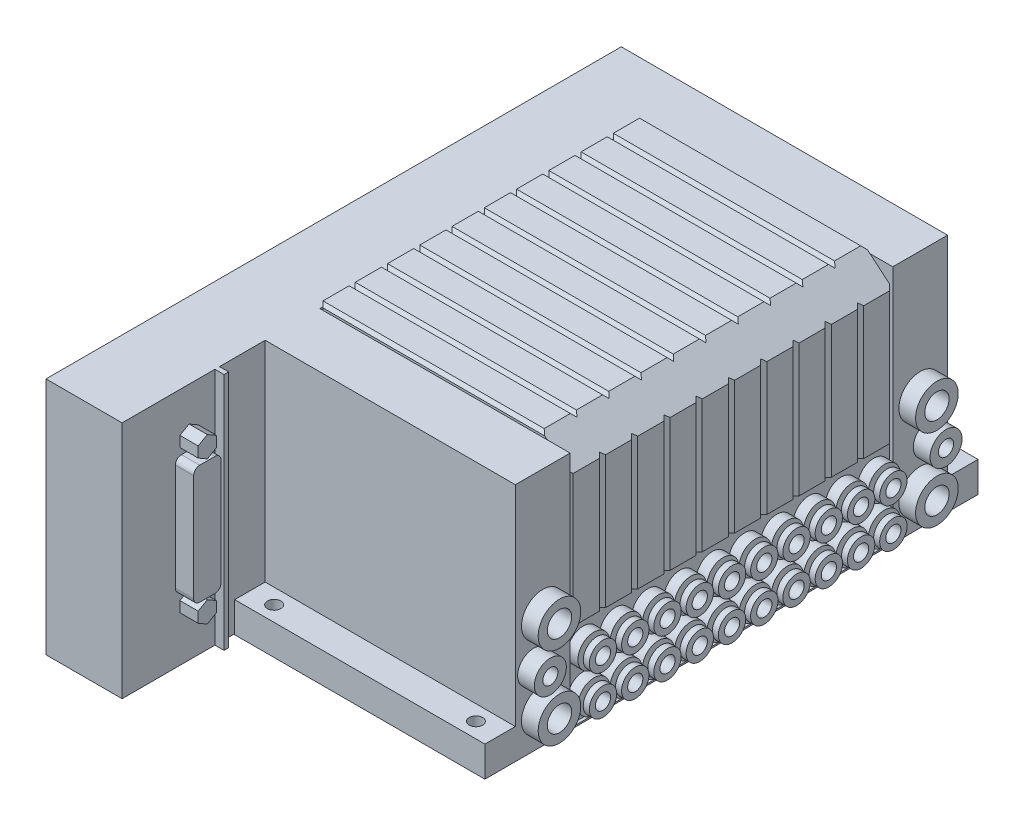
SolidWorks part; units mm, degrees
ref_plane "Längs" through (0, 0, 0) normal (0, 0, 1) x (1, 0, 0)
ref_plane "Oben" through (0, 0, 0) normal (0, 1, 0) x (1, 0, 0)
ref_plane "Quer" through (0, 0, 0) normal (1, 0, 0) x (0, 0, -1)
sketch "Skizze1" plane through (0, 0, 0) normal (0, 0, 1) x (1, 0, 0)
  line L0 (41.1, 40) -> (-41.1, -40) construction
  line L1 (-41.1, 40) -> (41.1, 40)
  line L2 (-41.1, 40) -> (-41.1, -40)
  line L3 (-41.1, -40) -> (41.1, -40)
  line L4 (41.1, 40) -> (41.1, -40)
  dimension "D1" = 82.2
  dimension "D2" = 80
extrude "Basis-Linear austragen" add sketch "Skizze1" along normal mid plane 10.6
sketch "Skizze2" plane through (41.1, 0, 0) normal (1, 0, 0) x (0, 0, -1)
  line L0 (5.3, -40) -> (5.3, 40) construction
  line L1 (-5.3, -40) -> (5.3, -40)
  line L2 (-5.3, -40) -> (-5.3, -11.5)
  line L3 (-5.3, -11.5) -> (5.3, -11.5)
  line L4 (5.3, -40) -> (5.3, -11.5)
  dimension "D1" = 28.5
extrude "Schnitt-Linear austragen1" cut sketch "Skizze2" against normal blind 1
sketch "Skizze3" plane through (0, 0, 0) normal (0, 0, 1) x (1, 0, 0)
  line L0 (26.5469, -19.3) -> (50.7651, -19.3) construction
  line L1 (43.6, -16.3) -> (44.6, -16.3)
  line L2 (40.1, -11.5) -> (40.1, -40) construction
  line L3 (44.6, -16.3) -> (44.6, -14.8)
  line L4 (44.6, -14.8) -> (46.6, -14.8)
  line L5 (46.6, -14.8) -> (46.6, -16.8)
  line L6 (46.6, -16.8) -> (40.1, -16.8)
  line L7 (40.1, -16.8) -> (40.1, -14.05)
  line L8 (-41.1, -40) -> (40.1, -40) construction
  line L10 (43.6, -16.3) -> (43.6, -14.05)
  line L11 (43.6, -14.05) -> (40.1, -14.05)
  line L12 (41.1, -11.5) -> (41.1, 40) construction
  dimension "D1" = 20.7
  dimension "D2" = 9
  dimension "D3" = 5
  dimension "D4" = 6
  dimension "D5" = 5.5
  dimension "D6" = 2
  dimension "D7" = 10.5
  dimension "D8" = 1
revolve "Aufsatz-Rotationskörper1" add sketch "Skizze3" angle 360 about L0
pattern_linear "Lineares Muster1" count 2 spacing 13
sketch "Skizze5" plane through (0, -11.5, 0) normal (0, -1, 0) x (1, 0, 0)
  line L0 (40.1, -5.3) -> (41.1, -4.3)
  line L4 (41.1, -5.3) -> (41.1, 5.3) construction
  line L5 (40.1, -5.3) -> (41.1, -5.3)
  line L6 (41.1, -4.3) -> (41.1, -5.3)
  dimension "D1" = 5.3
  dimension "D2" = 45
  dimension "D3" = 1
sketch "Skizze6" plane through (-41.1, 0, 0) normal (-1, 0, 0) x (0, 0, 1)
  line L0 (-5.3, 39) -> (-4.3, 40)
  line L3 (5.3, 40) -> (-5.3, 40) construction
  line L5 (-4.3, 40) -> (-5.3, 40)
  line L6 (-5.3, 39) -> (-5.3, 40)
  dimension "D1" = 5.3
  dimension "D2" = 1
  dimension "D3" = 45
extrude "Schnitt-Linear austragen9" cut sketch "Skizze6" against normal through all
sketch "Skizze7" plane through (0, -40, 0) normal (0, -1, 0) x (1, 0, 0)
  line L0 (-41.1, -4.3) -> (-40.1, -5.3)
  line L1 (-41.1, 5.3) -> (-41.1, -5.3) construction
  line L2 (-41.1, -4.3) -> (-41.1, -5.3)
  line L3 (-40.1, -5.3) -> (-41.1, -5.3)
  dimension "D1" = 5.3
  dimension "D2" = 45
  dimension "D3" = 1
extrude "Schnitt-Linear austragen11" cut sketch "Skizze7" against normal through all
extrude "Schnitt-Linear austragen8" cut sketch "Skizze5" against normal through all
mirror "Spiegeln1" about plane through (0, 0, 0) normal (0, 0, 1)
sketch "Skizze8" plane through (0, 0, 0) normal (0, 0, 1) x (1, 0, 0)
  line L0 (31.566, 40) -> (41.1, 32)
  line L3 (31.566, 40) -> (41.1, 40)
  line L4 (41.1, 32) -> (41.1, 40)
  line L5 (41.1, -11.5) -> (41.1, 40) construction
  dimension "D1" = 40
  dimension "D2" = 32
  dimension "D3" = 40
extrude "Schnitt-Linear austragen10" cut sketch "Skizze8" against normal mid plane 10.6
pattern_linear "Lineares Muster6" count 10 spacing 10.6
pattern_linear "Lineares Muster7" count 10 spacing 10.6
sketch "Skizze9" plane through (0, 0, 0) normal (1, 0, 0) x (0, 0, -1)
  line L0 (47.7, 55.0882) -> (47.7, -52.2534) construction
  line L2 (-5.3, 32.8391) -> (-5.3, -11.5) construction
  line L3 (-23.3, 38.3) -> (-23.3, -30.5)
  line L4 (-23.3, -30.5) -> (-33.3, -30.5)
  line L5 (-33.3, -30.5) -> (-33.3, -40.5)
  line L6 (-33.3, -40.5) -> (128.7, -40.5)
  line L7 (128.7, -40.5) -> (128.7, -30.5)
  line L8 (128.7, -30.5) -> (118.7, -30.5)
  line L9 (118.7, -30.5) -> (118.7, 38.3)
  line L10 (118.7, 38.3) -> (100.7, 38.3)
  line L11 (100.7, 38.3) -> (100.7, -40)
  line L12 (100.7, -40) -> (-5.3, -40)
  line L13 (-5.3, -40) -> (-5.3, 38.3)
  line L14 (-5.3, 38.3) -> (-23.3, 38.3)
  line L15 (-5.3, -40) -> (100.7, -40) construction
  line L16 (-5.3, -11.5) -> (-5.3, -40) construction
  dimension "D1" = 78.8
  dimension "D2" = 0.5
  dimension "D3" = 28
  dimension "D4" = 10
  dimension "D5" = 10
  dimension "3er-10er" = 53
extrude "Aufsatz-Linear austragen1" add sketch "Skizze9" along normal mid plane 82.2
hole_wizard "Ø 4.400000 Bohrung1" positions "Skizze11" profile "Skizze10" hole size "M4.4" standard "DIN"
sketch "Skizze11" plane through (0, -30.5, 0) normal (0, 1, 0) x (-1, 0, 0)
  line L0 (47.3303, -47.7) -> (-67.1929, -47.7) construction
  line L2 (-41.1, -128.7) -> (41.1, -128.7) construction
  line L3 (-41.1, 33.3) -> (41.1, 33.3) construction
  line L4 (0, 38.0034) -> (0, 16.4595) construction
  point P0 (-33.15, 28.3)
  point P1 (33.15, 28.3)
  point P2 (33.15, -123.7)
  point P3 (-33.15, -123.7)
  dimension "D1" = 5
  dimension "D2" = 66.3
sketch "Skizze10" plane through (33.15, -30.5, 28.3) normal (1, 0, 0) x (0, 0, 1)
  line L0 (0, 0) -> (0, 10)
  line L1 (0, 10) -> (2.2, 10)
  line L2 (2.2, 10) -> (2.2, 0)
  line L5 (2.2, 0) -> (0, 0)
  line L11 (0, -6.35) -> (0, 107.95) construction
  dimension "Bohrerdurchmesser" = 4.4
  dimension "Bohrungstiefe" = 10
sketch "Skizze13" plane through (0, 38.3, 0) normal (0, 1, 0) x (-1, 0, 0)
  line L0 (41.1, 38.3) -> (38.1, 38.3)
  line L1 (41.1, -118.7) -> (66.1, -118.7)
  line L2 (41.1, -118.7) -> (41.1, 38.3)
  line L3 (41.1, 70.3) -> (66.1, 70.3)
  line L4 (66.1, -118.7) -> (66.1, 70.3)
  line L5 (38.1, 38.3) -> (38.1, 39.8)
  line L6 (38.1, 39.8) -> (41.1, 39.8)
  line L7 (41.1, 39.8) -> (41.1, 70.3)
  line L9 (-41.1, 23.3) -> (41.1, 23.3) construction
  dimension "D1" = 25
  dimension "D2" = 3
  dimension "D3" = 15
  dimension "D4" = 1.5
  dimension "D5" = 47
extrude "Aufsatz-Linear austragen2" add sketch "Skizze13" against normal blind 78.5
sketch "Skizze14" plane through (-41.1, 0, 0) normal (1, 0, 0) x (0, 0, -1)
  line L0 (-48.3, 41.5333) -> (-48.3, -48.8758) construction
  line L1 (-50.8, 19.5) -> (-45.8, 19.5)
  line L2 (-52.8, 17.5) -> (-52.8, -17.5)
  line L3 (-50.8, -19.5) -> (-45.8, -19.5)
  line L4 (-43.8, 17.5) -> (-43.8, -17.5)
  line L5 (-75.3792, 0) -> (-45.8252, 0) construction
  line L6 (-23.3, 38.3) -> (-23.3, -30.5) construction
  line L8 (-45.3, 21.7679) -> (-45.3, 25.2321)
  line L9 (-45.3, 25.2321) -> (-48.3, 26.9641)
  line L10 (-48.3, 26.9641) -> (-51.3, 25.2321)
  line L11 (-51.3, 25.2321) -> (-51.3, 21.7679)
  line L12 (-51.3, 21.7679) -> (-48.3, 20.0359)
  line L13 (-48.3, 20.0359) -> (-45.3, 21.7679)
  line L14 (-48.3, -26.9641) -> (-45.3, -25.2321)
  line L15 (-45.3, -25.2321) -> (-45.3, -21.7679)
  line L16 (-45.3, -21.7679) -> (-48.3, -20.0359)
  line L17 (-48.3, -20.0359) -> (-51.3, -21.7679)
  line L18 (-51.3, -21.7679) -> (-51.3, -25.2321)
  line L19 (-51.3, -25.2321) -> (-48.3, -26.9641)
  arc A0 (-50.8, 19.5) -> (-52.8, 17.5) centre (-50.8, 17.5) ccw
  arc A1 (-45.8, 19.5) -> (-43.8, 17.5) centre (-45.8, 17.5) cw
  arc A2 (-45.8, -19.5) -> (-43.8, -17.5) centre (-45.8, -17.5) ccw
  arc A3 (-52.8, -17.5) -> (-50.8, -19.5) centre (-50.8, -17.5) ccw
  circle A4 centre (-48.3, 23.5) radius 3 construction
  circle A5 centre (-48.3, -23.5) radius 3 construction
  dimension "D4" = 2
  dimension "D1" = 25
  dimension "D2" = 9
  dimension "D3" = 39
  dimension "D5" = 47
  dimension "D6" = 6
  dimension "D7" = 6
extrude "Aufsatz-Linear austragen3" add sketch "Skizze14" along normal blind 6
sketch "Skizze15" plane through (41.1, 0, 0) normal (1, 0, 0) x (0, 0, -1)
  line L0 (47.7, 46.5749) -> (47.7, -49.0753) construction
  line L1 (118.7, -30.5) -> (118.7, 38.3) construction
  line L2 (-23.3, 38.3) -> (-23.3, -30.5) construction
  line L3 (-33.3, -40.5) -> (128.7, -40.5) construction
  circle A0 centre (-14.3, -3) radius 7
  circle A1 centre (109.7, -3) radius 7
  circle A2 centre (109.7, -30) radius 7
  circle A3 centre (-14.3, -30) radius 7
  circle A4 centre (112.7, -16.5) radius 5.25
  circle A5 centre (-17.3, -16.5) radius 5.25
  dimension "D4" = 14
  dimension "D5" = 14
  dimension "D6" = 14
  dimension "D7" = 14
  dimension "D10" = 10.5
  dimension "D11" = 10.5
  dimension "D1" = 9
  dimension "D2" = 10.5
  dimension "D3" = 37.5
  dimension "D8" = 24
  dimension "D9" = 3
extrude "Aufsatz-Linear austragen4" add sketch "Skizze15" against normal up to surface (5.5 mm away)
hole_wizard "Ø 8.000000 Bohrung1" positions "Skizze17" profile "Skizze16" hole size "M8.0" standard "DIN"
sketch "Skizze17" plane through (46.6, 0, 0) normal (1, 0, 0) x (0, 0, -1)
  circle A0 centre (-14.3, -30) radius 7 construction
  circle A1 centre (109.7, -30) radius 7 construction
  circle A2 centre (109.7, -3) radius 7 construction
  circle A3 centre (-14.3, -3) radius 7 construction
  point P0 (-14.3, -3)
  point P1 (109.7, -3)
  point P2 (109.7, -30)
  point P3 (-14.3, -30)
sketch "Skizze16" plane through (46.6, -3, 14.3) normal (0, 1, 0) x (0, 0, -1)
  line L0 (0, 0) -> (0, 12.4034)
  line L1 (0, 12.4034) -> (4, 10)
  line L2 (4, 10) -> (4, 0)
  line L5 (4, 0) -> (0, 0)
  line L10 (0, 12.4034) -> (-4, 10) construction
  line L11 (0, -6.35) -> (0, 107.95) construction
  dimension "Bohrerdurchmesser" = 8
  dimension "Bohrungstiefe" = 10
  dimension "Spitzenwinkel" = 118
hole_wizard "Ø 5.000000 Bohrung1" positions "Skizze19" profile "Skizze18" hole size "M5.0" standard "DIN"
sketch "Skizze19" plane through (46.6, 0, 0) normal (1, 0, 0) x (0, 0, -1)
  circle A0 centre (112.7, -16.5) radius 5.25 construction
  circle A1 centre (-17.3, -16.5) radius 5.25 construction
  point P0 (-17.3, -16.5)
  point P1 (112.7, -16.5)
sketch "Skizze18" plane through (46.6, -16.5, 17.3) normal (0, 1, 0) x (0, 0, -1)
  line L0 (0, 0) -> (0, 11.5022)
  line L1 (0, 11.5022) -> (2.5, 10)
  line L2 (2.5, 10) -> (2.5, 0)
  line L5 (2.5, 0) -> (0, 0)
  line L10 (0, 11.5022) -> (-2.5, 10) construction
  line L11 (0, -6.35) -> (0, 107.95) construction
  dimension "Bohrerdurchmesser" = 5
  dimension "Bohrungstiefe" = 10
  dimension "Spitzenwinkel" = 118
